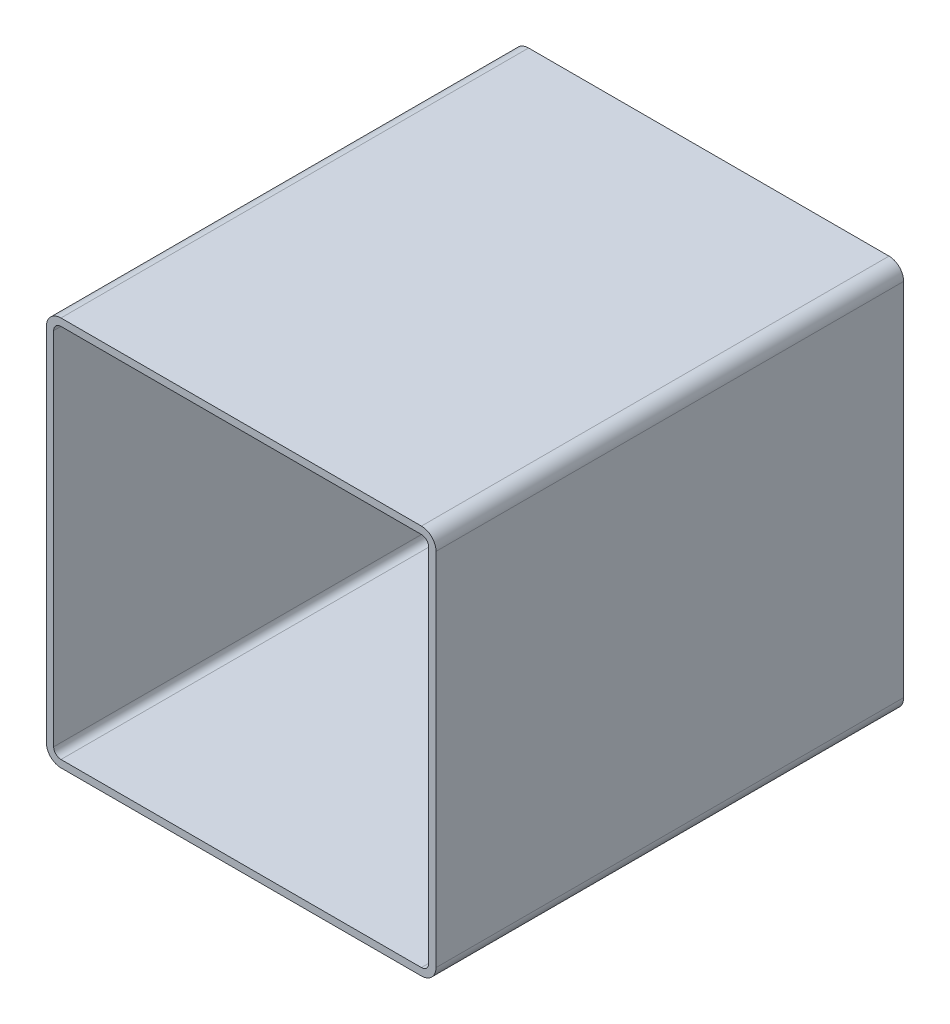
SolidWorks part; units mm, degrees
ref_plane "Front Plane" through (0, 0, 0) normal (0, 0, 1) x (1, 0, 0)
ref_plane "Top Plane" through (0, 0, 0) normal (0, 1, 0) x (1, 0, 0)
ref_plane "Right Plane" through (0, 0, 0) normal (1, 0, 0) x (0, 0, -1)
sketch "Sketch1" plane through (0, 0, 0) normal (0, 0, 1) x (1, 0, 0)
sketch_block_instance "HSS10x10x0.1875-1"
sketch_block "HSS10x10x0.1875"
extrude "Boss-Extrude1" add sketch "Sketch1" along normal blind 304.8
